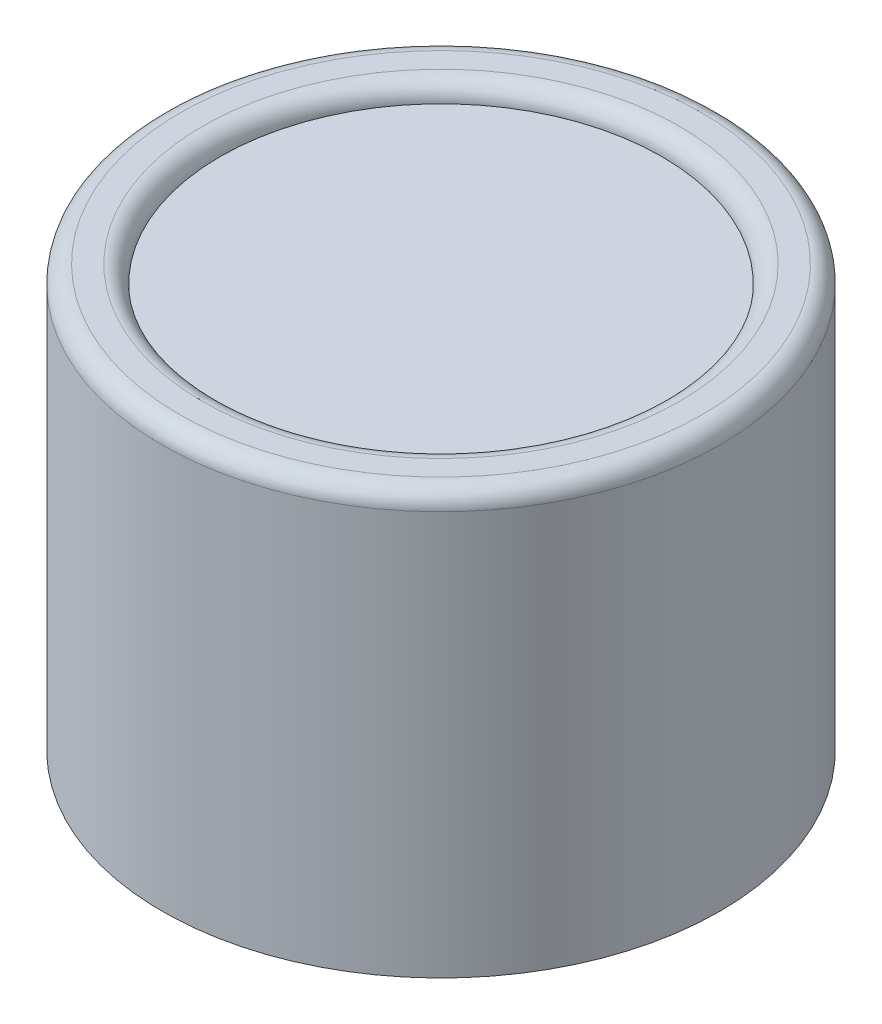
SolidWorks part; units mm, degrees
ref_plane "Front Plane" through (0, 0, 0) normal (0, 0, 1) x (1, 0, 0)
ref_plane "Top Plane" through (0, 0, 0) normal (0, 1, 0) x (1, 0, 0)
ref_plane "Right Plane" through (0, 0, 0) normal (1, 0, 0) x (0, 0, -1)
sketch "Sketch1" plane through (0, 0, 0) normal (0, 0, 1) x (1, 0, 0)
  line L0 (0, 0) -> (0, -11.5)
  line L1 (0, -11.5) -> (7.94, -11.5)
  line L2 (7.94, -11.5) -> (7.94, 0.5)
  line L3 (7.94, 0.5) -> (6.29, 0.5)
  line L4 (6.29, 0.5) -> (6.29, 0)
  line L5 (6.29, 0) -> (0, 0)
  dimension "D1" = 12
  dimension "D2" = 7.94
  dimension "D3" = 1.65
  dimension "D4" = 0.5
revolve "Revolve1" add sketch "Sketch1" angle 360 about L0
fillet "Fillet1" radius 0.5 2 edges at (-6.29, 0.5, 0) (-7.94, 0.5, 0)
